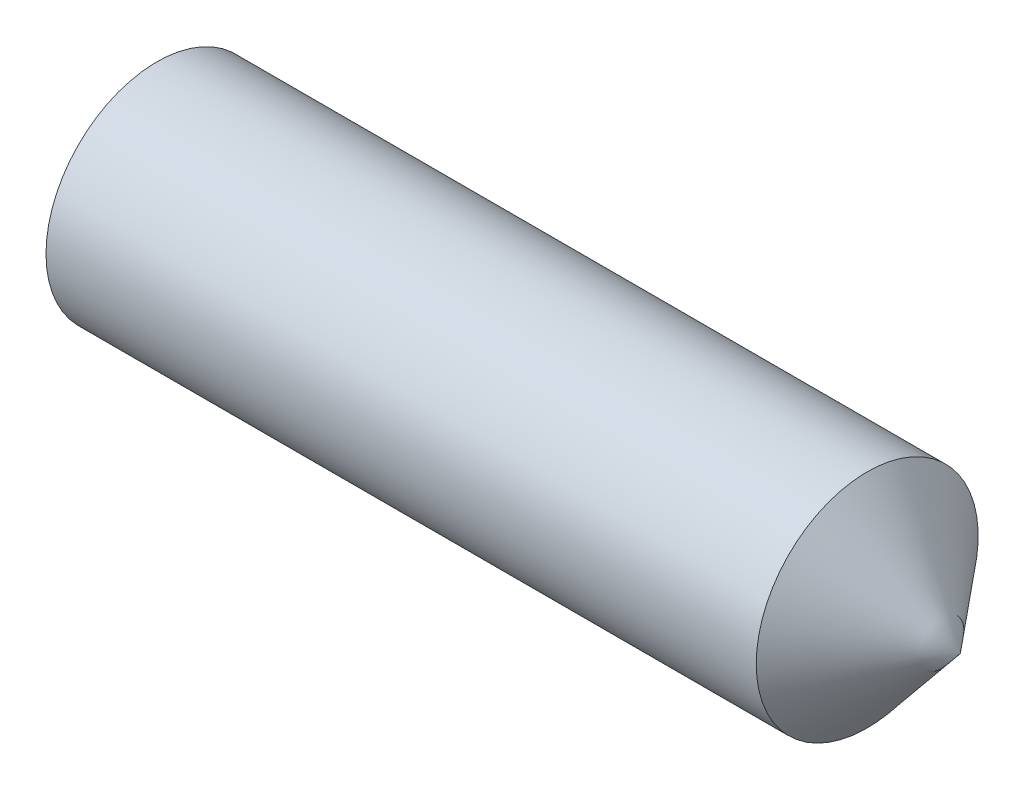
SolidWorks part; units mm, degrees
ref_plane "Plan1" through (0, 0, 0) normal (0, 0, 1) x (1, 0, 0)
ref_plane "Plan2" through (0, 0, 0) normal (0, 1, 0) x (1, 0, 0)
ref_plane "Plan3" through (0, 0, 0) normal (1, 0, 0) x (0, 0, -1)
sketch "Esquisse1" plane through (0, 0, 0) normal (0, 0, 1) x (1, 0, 0)
  line L0 (-50, 0) -> (50, 0) construction
  line L1 (-40, 3) -> (-20.8, 3)
  line L2 (-40, 3) -> (-40, 0)
  line L3 (-40, 0) -> (-18.2827, 0)
  line L4 (-20.8, 3) -> (-18.2827, 0)
  dimension "D1" = 3
  dimension "D3" = 50
revolve "Base-Révolution" add sketch "Esquisse1" angle 360 about L0
